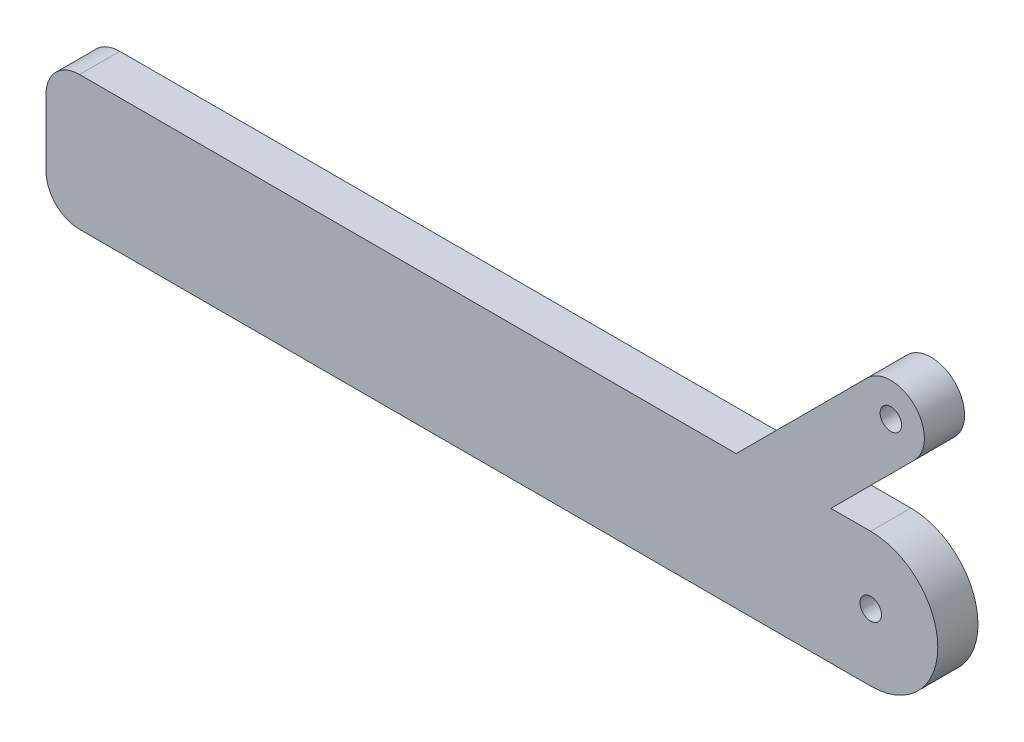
SolidWorks part; units mm, degrees
ref_plane "Plan de face" through (0, 0, 0) normal (0, 0, 1) x (1, 0, 0)
ref_plane "Plan de dessus" through (0, 0, 0) normal (0, 1, 0) x (1, 0, 0)
ref_plane "Plan de droite" through (0, 0, 0) normal (1, 0, 0) x (0, 0, -1)
sketch "Esquisse1" plane through (0, 0, 0) normal (0, 0, 1) x (1, 0, 0)
  line L0 (182.2501, 0) -> (-164.2748, 0) construction
  line L1 (0, -20.5495) -> (0, 63.7295) construction
  line L2 (-100, -20.5495) -> (-100, 96.894) construction
  line L3 (-175.6383, -10) -> (167.9637, -10) construction
  line L4 (-175.6383, 10) -> (167.9637, 10) construction
  line L6 (182.2501, 26) -> (7.9433, 26) construction
  line L7 (0, 0) -> (53.7129, 53.7129) construction
  line L8 (-17.9797, -10.9086) -> (38.7722, 45.8432) construction
  line L9 (-6.3871, -13.4582) -> (53.2982, 46.2271) construction
  line L10 (23, -20.5495) -> (23, 12.6403) construction
  line L11 (4.0635, 21) -> (167.9637, 21) construction
  line L12 (4.0635, 31) -> (167.9637, 31) construction
  line L13 (23, 10) -> (17.0711, 10)
  line L14 (14.8643, 37.1357) -> (31.0023, 20.9977) construction
  line L15 (22.4645, 29.5355) -> (2.9289, 10)
  line L16 (2.9289, 10) -> (-95, 10)
  line L17 (-100, 5) -> (-100, -5)
  line L18 (-95, -10) -> (23, -10)
  line L19 (29.5355, 22.4645) -> (17.0711, 10)
  circle A0 centre (23, 0) radius 10 construction
  circle A1 centre (26, 26) radius 5 construction
  arc A2 (23, -10) -> (23, 10) centre (23, 0) ccw
  circle A3 centre (23, 0) radius 1.6
  circle A4 centre (26, 26) radius 1.6
  arc A5 (29.5355, 22.4645) -> (22.4645, 29.5355) centre (26, 26) ccw
  arc A6 (-100, -5) -> (-95, -10) centre (-95, -5) ccw
  arc A7 (-95, 10) -> (-100, 5) centre (-95, 5) ccw
  point P38 (-100, -10)
  point P46 (-100, 10)
  dimension "D12" = 5
  dimension "D1" = 100
  dimension "D2" = 10
  dimension "D3" = 20
  dimension "D5" = 26
  dimension "D6" = 135
  dimension "D7" = 5
  dimension "D8" = 5
  dimension "D9" = 10
  dimension "D10" = 5
  dimension "D11" = 23
  dimension "D13" = 90
extrude "Boss.-Extru.1" add sketch "Esquisse1" along normal blind 6
